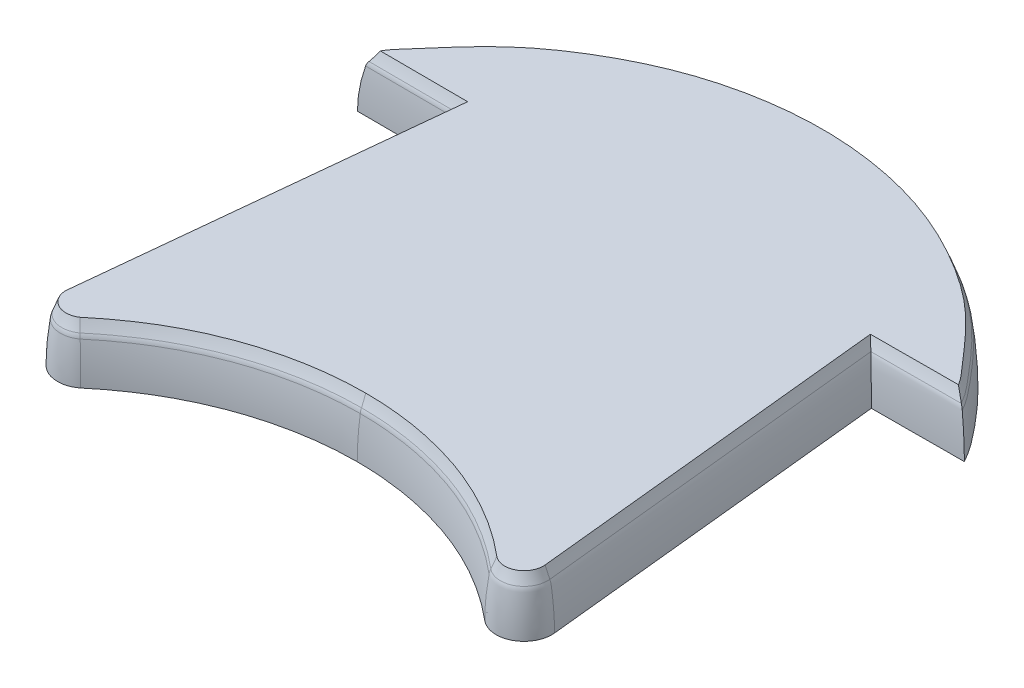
SolidWorks part; units mm, degrees
ref_plane "Plane1" through (0, 0, 0) normal (0, 0, 1) x (1, 0, 0)
ref_plane "Plane2" through (0, 0, 0) normal (0, 1, 0) x (1, 0, 0)
ref_plane "Plane3" through (0, 0, 0) normal (1, 0, 0) x (0, 0, -1)
sketch "Sketch1" plane through (0, 0, 0) normal (0, 1, 0) x (1, 0, 0)
  line L0 (0, 0) -> (0, -47.2722) construction
  line L1 (0, 0) -> (0, 47.2722) construction
  line L2 (47.7239, 0) -> (0, 0) construction
  line L3 (0, 0) -> (-49.8316, 0) construction
  line L4 (55.5611, 18.4644) -> (38.4929, 18.3974)
  line L5 (38.4929, 18.3974) -> (44.6508, -41.6714)
  line L6 (-38.4929, 18.3974) -> (-44.6508, -41.6714)
  line L7 (-55.5611, 18.4644) -> (-38.4929, 18.3974)
  arc A0 (34.232, -47.1663) -> (-34.232, -47.1663) centre (0, -87.6192) ccw
  arc A1 (55.5611, 18.4644) -> (-55.5611, 18.4644) centre (0, -12.345) ccw
  arc A2 (-44.6508, -41.6714) -> (-34.232, -47.1663) centre (-38.3339, -42.319) ccw
  arc A3 (44.6508, -41.6714) -> (34.232, -47.1663) centre (38.3339, -42.319) cw
  point P16 (-46.8156, -62.7885)
  point P19 (46.8156, -62.7885)
  dimension "D1" = 52.9931
  dimension "D2" = 63.5315
  dimension "D5" = 6.35
  dimension "D3" = 17.0683
  dimension "D4" = 81.6113
extrude "Boss-Extrude1" add sketch "Sketch1" along normal blind 9.652
sketch "Sketch2"
sketch_block_instance "Block1-1"
sketch_block "Block1" parameters "D4"=47.0072, "D5"=3.0267, "D6"=28.1695, "D1"=2.9761, "D2"=9.652, "D3"=1.4881, "D7"=5.0113
sketch "Sketch3" plane through (0, 9.652, 0) normal (0, 1, 0) x (1, 0, 0)
  line L4 (-55.5611, 18.4644) -> (-38.4929, 18.3974)
  line L5 (-38.4929, 18.3974) -> (-44.6508, -41.6714)
  line L6 (44.6508, -41.6714) -> (38.4929, 18.3974)
  line L7 (38.4929, 18.3974) -> (55.5611, 18.4644)
  line L8 (-55.5611, 18.4644) -> (-38.4929, 18.3974)
  line L9 (-38.4929, 18.3974) -> (-44.6508, -41.6714)
  line L10 (44.6508, -41.6714) -> (38.4929, 18.3974)
  line L11 (38.4929, 18.3974) -> (55.5611, 18.4644)
  arc A2 (55.5611, 18.4644) -> (-55.5611, 18.4644) centre (0, -12.345) ccw
  arc A3 (34.232, -47.1663) -> (-34.232, -47.1663) centre (0, -87.6192) ccw
  arc A4 (55.5611, 18.4644) -> (-55.5611, 18.4644) centre (0, -12.345) ccw
  arc A5 (34.232, -47.1663) -> (-34.232, -47.1663) centre (0, -87.6192) ccw
  arc A8 (-44.6508, -41.6714) -> (-34.232, -47.1663) centre (-38.3339, -42.319) ccw
  arc A9 (-44.6508, -41.6714) -> (-34.232, -47.1663) centre (-38.3339, -42.319) ccw
  arc A10 (34.232, -47.1663) -> (44.6508, -41.6714) centre (38.3339, -42.319) ccw
  arc A11 (34.232, -47.1663) -> (44.6508, -41.6714) centre (38.3339, -42.319) ccw
  dimension "D1" = 0
sketch "Sketch7" plane through (0, 9.652, 0) normal (0, 1, 0) x (1, 0, 0)
  arc A0 (55.5611, 18.4644) -> (-55.5611, 18.4644) centre (0, -12.345) ccw construction
  point P0 (0, -12.345)
  point P4 (0, -87.6192)
sweep "Cut-Sweep3" cut profiles "Sketch2" path "Sketch3"
sketch "Sketch8" plane through (0, 0, 0) normal (1, 0, 0) x (0, 0, -1)
  line L0 (-12.345, 9.652) -> (-12.345, 0) construction
  line L3 (19.879, 0) -> (-41.8232, 0) construction
  dimension "D1" = 9.652
ref_plane "Plane5" through (6.1387, 0, 6.8177) normal (0.6691, 0, 0.7431) x (0.7431, 0, -0.6691)
sketch "Sketch9" plane through (6.1387, 0, 6.8177) normal (0.6691, 0, 0.7431) x (0.7431, 0, -0.6691)
  line L1 (52.1992, 9.652) -> (-23.2094, 9.652) construction
  line L3 (51.8759, 9.652) -> (40.4498, 9.652) construction
  line L4 (51.8759, 9.652) -> (40.4498, 9.652)
  line L10 (52.1992, 9.652) -> (-23.2094, 9.652)
  ellipse E0 centre (-74.2655, 19.0954) end of major axis (-20.0736, 19.0954) minor radius 28.1695 (-24.6275, 7.7923) -> (-23.2094, 9.652) ccw construction
  ellipse E2 centre (-19.2942, 6.5778) end of major axis (-13.4715, 6.5778) minor radius 3.0267 (-24.6275, 7.7923) -> (-25.051, 7.0313) ccw construction
  ellipse E3 centre (64.3595, -0.0127) end of major axis (-26.0721, -0.0127) minor radius 47.0072 (-25.051, 7.0313) -> (-26.0721, 0) ccw construction
  ellipse E4 centre (-74.2655, 19.0954) end of major axis (-128.4575, 19.0954) minor radius 28.1695 (-24.6275, 7.7923) -> (-23.2094, 9.652) ccw
  ellipse E5 centre (-19.2942, 6.5778) end of major axis (-25.1168, 6.5778) minor radius 3.0267 (-24.6275, 7.7923) -> (-25.051, 7.0313) ccw
  ellipse E6 centre (64.3595, -0.0127) end of major axis (-26.0721, -0.0127) minor radius 47.0072 (-25.051, 7.0313) -> (-26.0721, 0) ccw
  spline S7 degree 3 poles (2052.976, -38.6104) (33.0747, -40.8471) (54.0887, -19.8187) (53.726, 1.0942) (53.7152, 1.4883) (53.7035, 1.8148) (53.6904, 2.1179) (53.6653, 2.6156) (53.6208, 3.3059) (53.5433, 4.2152) (50.1906, 36.4189) (4.0653, 62.9459) (2022.9414, 348.8928) knots -8.671907 -8.671907 -8.671907 -8.671907 0.089363 0.160911 0.214619 0.256854 0.29972 0.343508 0.468553 0.593606 0.731276 14.22724 14.22724 14.22724 14.22724 only from (53.7339, 0) to (53.1861, 7.0313) construction
  spline S8 degree 3 poles (53.7339, 0) (53.7342, 0.2103) (53.7347, 0.5891) (53.726, 1.0942) (53.7152, 1.4883) (53.7035, 1.8148) (53.6904, 2.1179) (53.6653, 2.6156) (53.6208, 3.3059) (53.5433, 4.2152) (53.4138, 5.4591) (53.2767, 6.4055) (53.1861, 7.0313) knots 0 0 0 0 0.089363 0.160911 0.214619 0.256854 0.29972 0.343508 0.468553 0.593606 0.731276 1 1 1 1
  spline S11 degree 3 poles (-1838.4918, -641.4765) (78.9045, -13.7518) (58.4572, -5.0742) (52.6798, 8.4308) (52.5267, 8.8022) (45.9212, 25.4683) (56.881, 49.4844) (-1807.0263, -726.7004) knots -21.384365 -21.384365 -21.384365 -21.384365 0.159799 0.339725 0.539772 0.759895 27.12989 27.12989 27.12989 27.12989 only from (52.959, 7.7923) to (52.1992, 9.652) construction
  spline S12 degree 3 poles (-807.5101, 1810.5443) (739.3033, -1907.2796) (-441.801, 1980.2983) (339.6759, -1969.8757) knots -52.276995 -52.276995 -52.276995 -52.276995 53.399202 53.399202 53.399202 53.399202 only from (53.1861, 7.0313) to (52.959, 7.7923) construction
  spline S13 degree 3 poles (52.959, 7.7923) (52.9152, 7.8902) (52.822, 8.0983) (52.6798, 8.4308) (52.5267, 8.8022) (52.3639, 9.2129) (52.2556, 9.5015) (52.1992, 9.652) knots 0 0 0 0 0.159799 0.339725 0.539772 0.759895 1 1 1 1
  spline S14 degree 3 poles (53.1861, 7.0313) (53.1456, 7.2924) (53.0685, 7.5504) (52.959, 7.7923) knots 0 0 0 0 1 1 1 1
sketch_block_instance "Block1-4"
